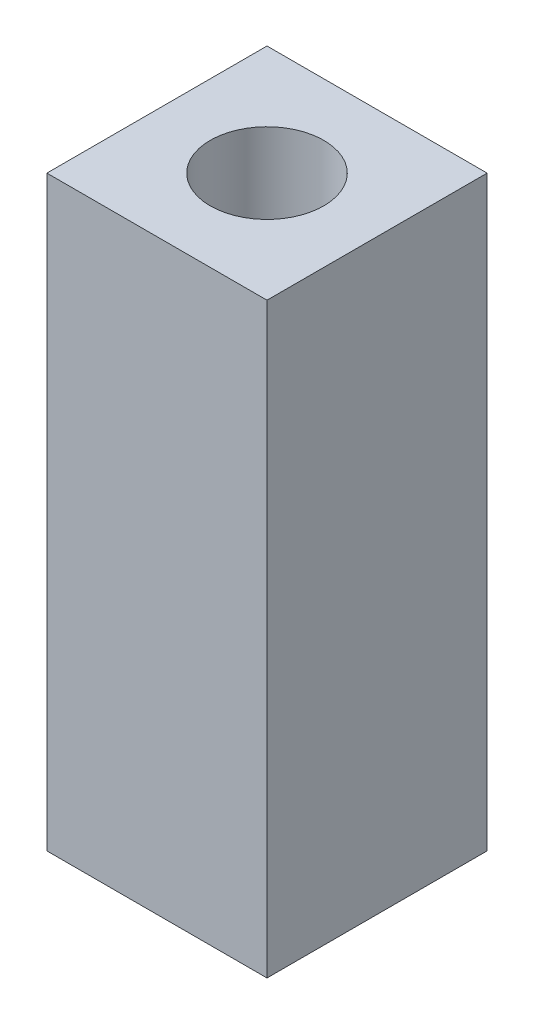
SolidWorks part; units mm, degrees
ref_plane "Front Plane" through (0, 0, 0) normal (0, 0, 1) x (1, 0, 0)
ref_plane "Top Plane" through (0, 0, 0) normal (0, 1, 0) x (1, 0, 0)
ref_plane "Right Plane" through (0, 0, 0) normal (1, 0, 0) x (0, 0, -1)
sketch "Sketch1" plane through (0, 0, 0) normal (0, 1, 0) x (1, 0, 0)
  line L1 (-4.7625, -4.7625) -> (4.7625, -4.7625)
  line L2 (-4.7625, -4.7625) -> (-4.7625, 4.7625)
  line L3 (-4.7625, 4.7625) -> (4.7625, 4.7625)
  line L4 (4.7625, -4.7625) -> (4.7625, 4.7625)
  line L5 (-4.7625, -4.7625) -> (4.7625, 4.7625) construction
  line L6 (-4.7625, 4.7625) -> (4.7625, -4.7625) construction
  point P0 (0, 0)
  dimension "D1" = 9.525
  dimension "D2" = 9.525
extrude "Boss-Extrude1" add sketch "Sketch1" along normal blind 25.4
hole_wizard "#10 (0.1935) Diameter Hole1" positions "Sketch3" profile "Sketch2" hole size "#10" standard "ANSI Inch"
sketch "Sketch3" plane through (0, 25.4, 0) normal (0, 1, 0) x (1, 0, 0)
  point P0 (0, 0)
sketch "Sketch2" plane through (0, 25.4, 0) normal (1, 0, 0) x (0, 0, 1)
  line L0 (0, 0) -> (0, 25.4)
  line L1 (0, 25.4) -> (2.4574, 25.4)
  line L2 (2.4574, 25.4) -> (2.4574, 0)
  line L5 (2.4574, 0) -> (0, 0)
  line L11 (0, -6.35) -> (0, 107.95) construction
  dimension "Thru Hole Dia." = 4.9149
  dimension "Thru Hole Depth" = 25.4
